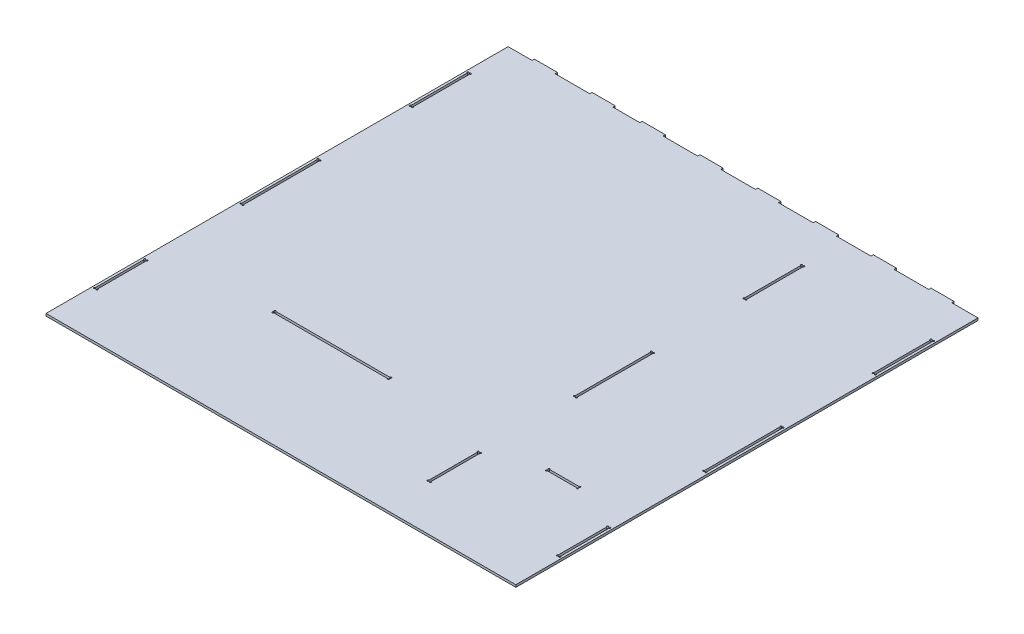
SolidWorks part; units mm, degrees
ref_plane "Front Plane" through (0, 0, 0) normal (0, 0, 1) x (1, 0, 0)
ref_plane "Top Plane" through (0, 0, 0) normal (0, 1, 0) x (1, 0, 0)
ref_plane "Right Plane" through (0, 0, 0) normal (1, 0, 0) x (0, 0, -1)
sketch "Sketch1" plane through (0, 0, 0) normal (0, 0, 1) x (1, 0, 0)
  line L0 (-548, 168) -> (-598, 168) construction
  line L3 (542, 168) -> (598, 168) construction
  line L9 (-598, 168) -> (598, 168)
  line L10 (-598, 168) -> (-598, 174)
  line L11 (-598, 174) -> (598, 174)
  line L12 (598, 168) -> (598, 174)
  line L22 (-548, 174) -> (-488, 174)
  line L23 (-548, 174) -> (-548, 168)
  line L24 (-548, 168) -> (-488, 168)
  line L25 (-488, 174) -> (-488, 168)
  line L26 (-398, 174) -> (-338, 174)
  line L27 (-398, 174) -> (-398, 168)
  line L28 (-398, 168) -> (-338, 168)
  line L29 (-338, 174) -> (-338, 168)
  line L30 (-268, 174) -> (-208, 174)
  line L31 (-268, 174) -> (-268, 168)
  line L32 (-268, 168) -> (-208, 168)
  line L33 (-208, 174) -> (-208, 168)
  line L34 (-118, 174) -> (-58, 174)
  line L35 (-118, 174) -> (-118, 168)
  line L36 (-118, 168) -> (-58, 168)
  line L37 (-58, 174) -> (-58, 168)
  line L38 (32, 174) -> (92, 174)
  line L39 (32, 174) -> (32, 168)
  line L40 (32, 168) -> (92, 168)
  line L41 (92, 174) -> (92, 168)
  line L42 (182, 174) -> (242, 174)
  line L43 (182, 174) -> (182, 168)
  line L44 (182, 168) -> (242, 168)
  line L45 (242, 174) -> (242, 168)
  line L46 (332, 174) -> (392, 174)
  line L47 (332, 174) -> (332, 168)
  line L48 (332, 168) -> (392, 168)
  line L49 (392, 174) -> (392, 168)
  line L50 (482, 174) -> (542, 174)
  line L51 (482, 174) -> (482, 168)
  line L52 (482, 168) -> (542, 168)
  line L53 (542, 174) -> (542, 168)
  line L70 (598, 174) -> (604, 174)
  line L78 (232, 168) -> (238, 168)
extrude "Boss-Extrude1" add sketch "Sketch1" along normal blind 1200 contours L23 L11 L10 L9 | L27 L11 L25 L9 | L31 L11 L29 L9 | L35 L11 L33 L9 | L39 L11 L37 L9 | L43 L11 L41 L9 | L47 L11 L45 L9 | L51 L11 L49 L9 | L11 L53 L9 L12
sketch "Sketch2" plane through (0, 168, 0) normal (0, -1, 0) x (1, 0, 0)
  line L0 (242, 0) -> (332, 0) construction
  line L1 (-548, 0) -> (-488, 0)
  line L2 (-548, 0) -> (-548, -6)
  line L3 (-548, -6) -> (-488, -6)
  line L4 (-488, 0) -> (-488, -6)
  line L5 (-398, 0) -> (-337.9846, 0)
  line L6 (-398, 0) -> (-398, -6)
  line L7 (-398, -6) -> (-337.9846, -6)
  line L8 (-337.9846, 0) -> (-337.9846, -6)
  line L9 (-268, 0) -> (-208, 0)
  line L10 (-268, 0) -> (-268, -6)
  line L11 (-268, -6) -> (-208, -6)
  line L12 (-208, 0) -> (-208, -6)
  line L13 (-118, 0) -> (-58, 0)
  line L14 (-118, 0) -> (-118, -6)
  line L15 (-118, -6) -> (-58, -6)
  line L16 (-58, 0) -> (-58, -6)
  line L17 (32, 0) -> (92, 0)
  line L18 (32, 0) -> (32, -6)
  line L19 (32, -6) -> (92, -6)
  line L20 (92, 0) -> (92, -6)
  line L21 (182, 0) -> (242, 0)
  line L22 (182, 0) -> (182, -6)
  line L23 (182, -6) -> (242, -6)
  line L24 (242, 0) -> (242, -6)
  line L25 (-58, 0) -> (32, 0) construction
  line L26 (-58, 1200) -> (-58, 0) construction
  line L27 (-208, 0) -> (-118, 0) construction
  line L28 (-338, 0) -> (-268, 0) construction
  line L30 (332, 0) -> (392, 0)
  line L31 (332, 0) -> (332, -6)
  line L32 (332, -6) -> (392, -6)
  line L33 (392, 0) -> (392, -6)
  line L34 (482, 0) -> (542, 0)
  line L35 (482, 0) -> (482, -6)
  line L36 (482, -6) -> (542, -6)
  line L37 (542, 0) -> (542, -6)
  line L38 (-598, 0) -> (598, 0)
  line L39 (-598, 0) -> (-598, 1200)
  line L40 (-598, 1200) -> (598, 1200)
  line L41 (598, 0) -> (598, 1200)
  dimension "D1" = 6
  dimension "D2" = 6
  dimension "D3" = 6
  dimension "D4" = 6
  dimension "D5" = 6
  dimension "D6" = 6
  dimension "D7" = 6
  dimension "D8" = 6
extrude "Boss-Extrude2" add sketch "Sketch2" against normal blind 6 contours L40 L39 L38 L1 M12 | L38 L41 L40 L5 L9 L13 L17 L21 L30 L34 M10 | M12 M9 M10 M11 | L4 L1 L2 L3 | L8 L5 L6 L7 | L12 L9 L10 L11 | L16 L13 L14 L15 | L20 L17 L18 L19 | L24 L21 L22 L23 | L33 L30 L31 L32 | L37 L34 L35 L36
sketch "Sketch3" plane through (0, 0, 1200) normal (0, 0, 1) x (1, 0, 0)
  line L0 (610, -180) -> (610, 180) construction
  line L1 (598, 168) -> (610, 168)
  line L2 (598, 168) -> (598, 174)
  line L3 (598, 174) -> (610, 174)
  line L4 (610, 168) -> (610, 174)
  line L5 (-598, 174) -> (598, 174) construction
  line L6 (-610, -180) -> (-610, 180) construction
  line L7 (-598, 174) -> (-610, 174)
  line L8 (-598, 174) -> (-598, 168)
  line L9 (-598, 168) -> (-610, 168)
  line L10 (-610, 174) -> (-610, 168)
  dimension "D1" = 0
extrude "Boss-Extrude3" add sketch "Sketch3" against normal up to surface (1200 mm away)
sketch "Sketch4" plane through (0, 174, 0) normal (0, 1, 0) x (1, 0, 0)
  line L1 (262, -950) -> (268, -950)
  line L2 (262, -950) -> (262, -1080)
  line L3 (262, -1080) -> (268, -1080)
  line L4 (268, -950) -> (268, -1080)
  line L5 (262, -500) -> (268, -500)
  line L6 (262, -500) -> (262, -700)
  line L7 (262, -700) -> (268, -700)
  line L8 (268, -500) -> (268, -700)
  line L9 (262, -110) -> (268, -110)
  line L10 (262, -110) -> (262, -260)
  line L11 (262, -260) -> (268, -260)
  line L12 (268, -110) -> (268, -260)
  line L13 (-604, -110) -> (-598, -110)
  line L14 (-604, -110) -> (-604, -260)
  line L15 (-604, -260) -> (-598, -260)
  line L16 (-598, -110) -> (-598, -260)
  line L17 (-604, -500) -> (-598, -500)
  line L18 (-604, -500) -> (-604, -700)
  line L19 (-604, -700) -> (-598, -700)
  line L20 (-598, -500) -> (-598, -700)
  line L21 (-604, -950) -> (-598, -950)
  line L22 (-604, -950) -> (-604, -1080)
  line L23 (-604, -1080) -> (-598, -1080)
  line L24 (-598, -950) -> (-598, -1080)
  line L25 (598, -110) -> (604, -110)
  line L26 (598, -110) -> (598, -260)
  line L27 (598, -260) -> (604, -260)
  line L28 (604, -110) -> (604, -260)
  line L29 (598, -500) -> (604, -500)
  line L30 (598, -500) -> (598, -700)
  line L31 (598, -700) -> (604, -700)
  line L32 (604, -500) -> (604, -700)
  line L33 (598, -950) -> (604, -950)
  line L34 (598, -950) -> (598, -1080)
  line L35 (598, -1080) -> (604, -1080)
  line L36 (604, -950) -> (604, -1080)
  circle A0 centre (-598, -110) radius 2
  circle A1 centre (-604, -110) radius 2
  circle A2 centre (-598, -260) radius 2
  circle A3 centre (-604, -260) radius 2
  circle A4 centre (-604, -500) radius 2
  circle A5 centre (-598, -500) radius 2
  circle A6 centre (-604, -700) radius 2
  circle A7 centre (-598, -700) radius 2
  circle A8 centre (-598, -950) radius 2
  circle A9 centre (-604, -950) radius 2
  circle A10 centre (-598, -1080) radius 2
  circle A11 centre (-604, -1080) radius 2
  circle A12 centre (262, -110) radius 2
  circle A13 centre (268, -110) radius 2
  circle A14 centre (268, -260) radius 2
  circle A15 centre (262, -260) radius 2
  circle A16 centre (268, -500) radius 2
  circle A17 centre (262, -500) radius 2
  circle A18 centre (268, -700) radius 2
  circle A19 centre (262, -700) radius 2
  circle A20 centre (268, -950) radius 2
  circle A21 centre (262, -950) radius 2
  circle A22 centre (268, -1080) radius 2
  circle A23 centre (262, -1080) radius 2
  circle A24 centre (598, -110) radius 2
  circle A25 centre (604, -110) radius 2
  circle A26 centre (604, -260) radius 2
  circle A27 centre (598, -260) radius 2
  circle A28 centre (604, -500) radius 2
  circle A29 centre (598, -500) radius 2
  circle A30 centre (604, -700) radius 2
  circle A31 centre (598, -700) radius 2
  circle A32 centre (604, -950) radius 2
  circle A33 centre (598, -950) radius 2
  circle A34 centre (604, -1080) radius 2
  circle A35 centre (598, -1080) radius 2
extrude "Cut-Extrude1" cut sketch "Sketch4" against normal blind 151 contours A3 L15 A2 L16 A0 L13 A1 L14 | L16 A0 L13 | L13 A0 L16 | L13 A1 L14 | L14 A1 L13 | L16 A2 L15 | L15 A2 L16 | L14 A3 L15 | L15 A3 L14 | A7 L20 A5 L17 A4 L18 A6 L19 | L17 A4 L18 | L18 A4 L17 | L20 A5 L17 | L17 A5 L20 | L19 A6 L18 | L18 A6 L19 | L19 A7 L20 | L20 A7 L19 | A11 L23 A10 L24 A8 L21 A9 L22 | L24 A8 L21 | L21 A8 L24 | L21 A9 L22 | L22 A9 L21 | L23 A10 L24 | L24 A10 L23 | L22 A11 L23 | L23 A11 L22 | A19 L7 A18 L8 A16 L5 A17 L6 | L6 A17 L5 | L5 A17 L6 | L8 A16 L5 | L5 A16 L8 | A15 L11 A14 L12 A13 L9 A12 L10 | L11 A14 L12 | L12 A14 L11 | L10 A15 L11 | L11 A15 L10 | L9 A13 L12 | L12 A13 L9 | L9 A12 L10 | L10 A12 L9 | A23 L3 A22 L4 A20 L1 A21 L2 | L1 A20 L4 | L4 A20 L1 | L1 A21 L2 | L2 A21 L1 | L4 A22 L3 | L3 A22 L4 | L3 A23 L2 | L2 A23 L3 | L36 A34 L35 | L35 A35 L34 | A35 L35 A34 L36 A32 L33 A33 L34 | L35 A34 L36 | L34 A35 L35 | L33 A32 L36 | L36 A32 L33 | L33 A33 L34 | L34 A33 L33 | A31 L31 A30 L32 A28 L29 A29 L30 | L31 A30 L32 | L32 A30 L31 | L31 A31 L30 | L30 A31 L31 | L25 A24 L26 | A27 L27 A26 L28 A25 L25 A24 L26 | L28 A25 L25 | L25 A25 L28 | L26 A24 L25 | L27 A26 L28 | L26 A27 L27 | L32 A28 L29 | L29 A29 L30 | L30 A29 L29 | L29 A28 L32 | L28 A26 L27
sketch "Sketch6" plane through (0, 168, 0) normal (0, -1, 0) x (-1, 0, 0)
  circle A0 centre (-598, -260) radius 2
extrude "Cut-Extrude2" cut sketch "Sketch6" against normal blind 10
sketch "Sketch7" plane through (0, 168, 0) normal (0, -1, 0) x (-1, 0, 0)
  circle A0 centre (-268, -700) radius 2
  circle A1 centre (-262, -700) radius 2
extrude "Cut-Extrude3" cut sketch "Sketch7" against normal blind 10
sketch "Sketch8" plane through (0, 174, 0) normal (0, 1, 0) x (1, 0, 0)
  line L1 (-316, -897) -> (-20, -897)
  line L2 (-318, -899) -> (-318, -901)
  line L3 (-316, -903) -> (-20, -903)
  line L4 (-18, -899) -> (-18, -901)
  line L5 (395, -897) -> (471, -897)
  line L6 (393, -899) -> (393, -901)
  line L7 (395, -903) -> (471, -903)
  line L8 (473, -899) -> (473, -901)
  arc A0 (-18, -899) -> (-20, -897) centre (-18, -897) ccw
  arc A1 (-20, -903) -> (-18, -901) centre (-18, -903) ccw
  arc A2 (-316, -897) -> (-318, -899) centre (-318, -897) ccw
  arc A3 (-318, -901) -> (-316, -903) centre (-318, -903) ccw
  arc A4 (395, -897) -> (393, -899) centre (393, -897) ccw
  arc A5 (393, -901) -> (395, -903) centre (393, -903) ccw
  arc A6 (473, -899) -> (471, -897) centre (473, -897) ccw
  arc A7 (471, -903) -> (473, -901) centre (473, -903) ccw
  dimension "D1" = 4
  dimension "D2" = 4
  dimension "D3" = 4
  dimension "D4" = 4
  dimension "D5" = 4
  dimension "D6" = 4
  dimension "D7" = 4
  dimension "D8" = 4
extrude "Cut-Extrude5" cut sketch "Sketch8" against normal blind 20
equation "\"D14@Sketch4\"=\"D13@Sketch4\""
equation "\"D15@Sketch4\"=\"D14@Sketch4\""
equation "\"D16@Sketch4\"=\"D15@Sketch4\""
